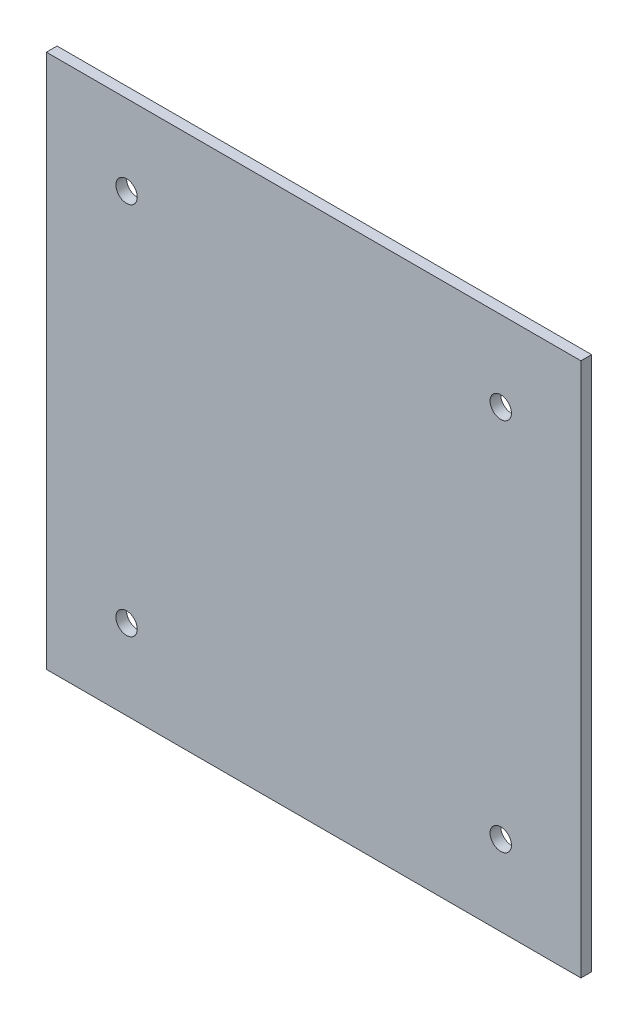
SolidWorks part; units mm, degrees
ref_plane "Plan de face" through (0, 0, 0) normal (0, 0, 1) x (1, 0, 0)
ref_plane "Plan de dessus" through (0, 0, 0) normal (0, 1, 0) x (1, 0, 0)
ref_plane "Plan de droite" through (0, 0, 0) normal (1, 0, 0) x (0, 0, -1)
sketch "Esquisse1" plane through (0, 0, 0) normal (0, 0, 1) x (1, 0, 0)
  line L1 (0, 0) -> (200, 0)
  line L2 (0, 0) -> (0, 200)
  line L3 (0, 200) -> (200, 200)
  line L4 (200, 0) -> (200, 200)
  dimension "D1" = 200
  dimension "D2" = 200
extrude "Extrusion1" add sketch "Esquisse1" along normal blind 4
sketch "Esquisse2" plane through (0, 0, 4) normal (0, 0, 1) x (1, 0, 0)
  line L0 (0, 200) -> (0, 0) construction
  line L1 (200, 200) -> (0, 200) construction
  circle A0 centre (30, 170) radius 4
  dimension "D2" = 30
  dimension "D3" = 8
  dimension "D1" = 30
extrude "Enlèv. mat.-Extru.1" cut sketch "Esquisse2" against normal through all
pattern_linear "Répétition linéaire1" count 2 spacing 140 along (1, 0, 0) count 2 spacing 140 along (0, -1, 0) of "Enlèv. mat.-Extru.1"
